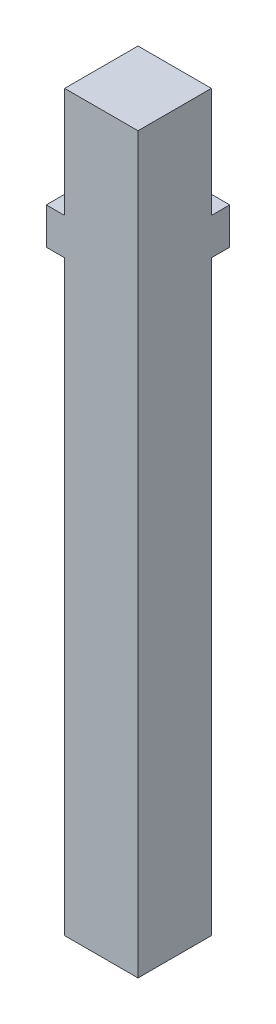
SolidWorks part; units mm, degrees
ref_plane "Front Plane" through (0, 0, 0) normal (0, 0, 1) x (1, 0, 0)
ref_plane "Top Plane" through (0, 0, 0) normal (0, 1, 0) x (1, 0, 0)
ref_plane "Right Plane" through (0, 0, 0) normal (1, 0, 0) x (0, 0, -1)
sketch "Sketch1" plane through (0, 0, 0) normal (0, 1, 0) x (1, 0, 0)
  line L1 (0, 0) -> (25.4, 0)
  line L2 (0, 0) -> (0, 25.4)
  line L3 (0, 25.4) -> (25.4, 25.4)
  line L4 (25.4, 0) -> (25.4, 25.4)
  dimension "D1" = 25.4
  dimension "D2" = 25.4
extrude "Boss-Extrude1" add sketch "Sketch1" along normal blind 254
sketch "Sketch2" plane through (0, 254, 0) normal (0, 1, 0) x (1, 0, 0)
  line L0 (0, 25.4) -> (0, 0) construction
  line L1 (-6.35, 0) -> (25.4, 0)
  line L2 (-6.35, 0) -> (-6.35, 31.75)
  line L3 (-6.35, 31.75) -> (25.4, 31.75)
  line L4 (25.4, 0) -> (25.4, 31.75)
  line L6 (25.4, 0) -> (25.4, 25.4) construction
  line L7 (0, 0) -> (25.4, 0) construction
  line L8 (25.4, 25.4) -> (0, 25.4) construction
  dimension "D1" = 6.35
  dimension "D2" = 0
  dimension "D3" = 0
  dimension "D4" = 6.35
extrude "Boss-Extrude2" add sketch "Sketch2" along normal blind 12.7 from offset 50.8
